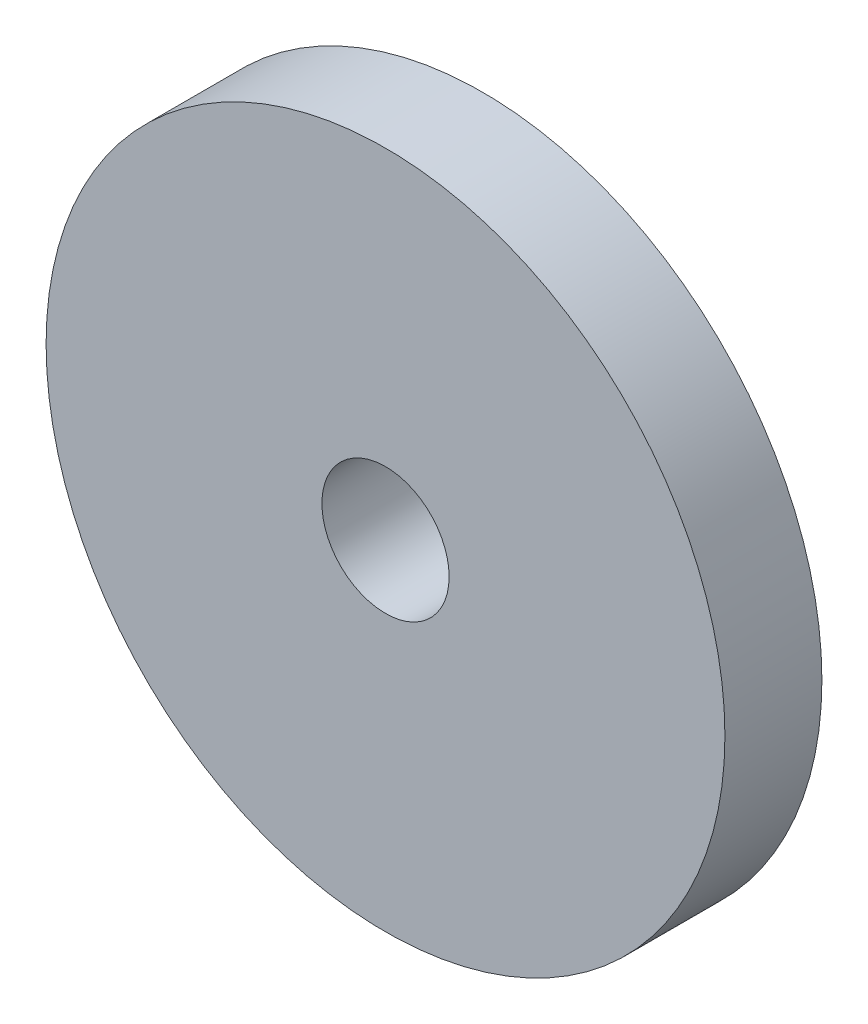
SolidWorks part; units mm, degrees
ref_plane "Front Plane" through (0, 0, 0) normal (0, 0, 1) x (1, 0, 0)
ref_plane "Top Plane" through (0, 0, 0) normal (0, 1, 0) x (1, 0, 0)
ref_plane "Right Plane" through (0, 0, 0) normal (1, 0, 0) x (0, 0, -1)
sketch "Sketch1" plane through (0, 0, 0) normal (0, 0, 1) x (1, 0, 0)
  circle A0 centre (0, 0) radius 11.1125
  dimension "D1" = 22.225
extrude "Boss-Extrude1" add sketch "Sketch1" along normal blind 3.175
sketch "Sketch2" plane through (0, 0, 3.175) normal (0, 0, 1) x (1, 0, 0)
  circle A0 centre (0, 0) radius 2.0828
  dimension "D1" = 4.1656
extrude "Cut-Extrude1" cut sketch "Sketch2" against normal through all
